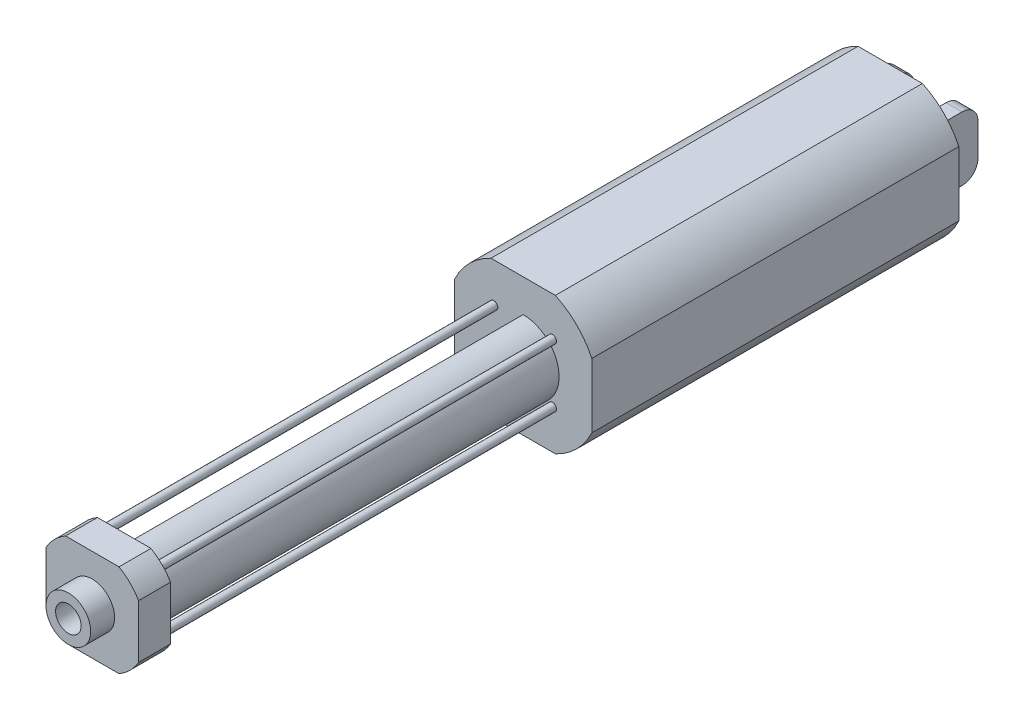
SolidWorks part; units mm, degrees
ref_plane "Plan1" through (0, 0, 0) normal (0, 0, 1) x (1, 0, 0)
ref_plane "Plan2" through (0, 0, 0) normal (0, 1, 0) x (1, 0, 0)
ref_plane "Plan3" through (0, 0, 0) normal (1, 0, 0) x (0, 0, -1)
sketch "Esquisse1" plane through (0, 0, 0) normal (0, 0, 1) x (1, 0, 0)
  line L0 (0, 86) -> (86, 0) construction
  line L1 (0, 0) -> (86, 0) construction
  line L2 (0, 0) -> (0, 86) construction
  line L3 (0, 86) -> (86, 86) construction
  line L4 (86, 0) -> (86, 86) construction
  line L6 (22.8196, 86) -> (63.1804, 86)
  line L7 (0, 63.1804) -> (0, 22.8196)
  line L8 (22.8196, 0) -> (63.1804, 0)
  line L9 (86, 63.1804) -> (86, 22.8196)
  arc A0 (86, 63.1804) -> (63.1804, 86) centre (43, 43) ccw
  arc A1 (22.8196, 86) -> (0, 63.1804) centre (43, 43) ccw
  arc A2 (0, 22.8196) -> (22.8196, 0) centre (43, 43) ccw
  arc A3 (63.1804, 0) -> (86, 22.8196) centre (43, 43) ccw
  dimension "D3" = 95
  dimension "D1" = 86
  dimension "D2" = 86
extrude "Base-Extrusion" add sketch "Esquisse1" along normal blind 230
sketch "Esquisse2" plane through (0, 0, 230) normal (0, 0, 1) x (1, 0, 0)
  line L0 (43, 86) -> (43, 0) construction
  line L1 (63.1804, 86) -> (22.8196, 86) construction
  line L2 (22.8196, 0) -> (63.1804, 0) construction
  line L3 (43, 43) -> (73, 43) construction
  line L4 (43, 43) -> (13, 43) construction
  line L5 (43, 65.5) -> (43, 63)
  line L6 (20.5, 43) -> (23, 43)
  arc A0 (20.5, 43) -> (43, 65.5) centre (43, 43) ccw
  arc A1 (23, 43) -> (43, 63) centre (43, 43) ccw
  dimension "D1" = 45
  dimension "D2" = 40
extrude "Boss.-Extru.1" add sketch "Esquisse2" along normal blind 250
sketch "Esquisse3" plane through (0, 0, 0) normal (0, 0, -1) x (-1, 0, 0)
  line L0 (-43, 86) -> (-43, 0) construction
  line L1 (-63.1804, 86) -> (-22.8196, 86) construction
  line L2 (-22.8196, 0) -> (-63.1804, 0) construction
  line L3 (-86, 43) -> (0, 43) construction
  line L4 (-86, 22.8196) -> (-86, 63.1804) construction
  line L5 (0, 63.1804) -> (0, 22.8196) construction
  line L6 (-68, 23) -> (-58, 23)
  line L7 (-68, 63) -> (-58, 63)
  line L8 (-68, 63) -> (-68, 23)
  line L9 (-28, 63) -> (-28, 23)
  line L10 (-58, 63) -> (-58, 23)
  line L11 (-18, 63) -> (-18, 23)
  line L12 (-18, 63) -> (-28, 63)
  line L13 (-18, 23) -> (-28, 23)
  point P14 (-58, 43)
  point P18 (-68, 43)
  point P22 (-18, 43)
  point P23 (-28, 43)
  dimension "D1" = 30
  dimension "D2" = 10
  dimension "D3" = 20
extrude "Boss.-Extru.2" add sketch "Esquisse3" along normal blind 30
sketch "Esquisse4" plane through (18, 0, 0) normal (-1, 0, 0) x (0, 0, 1)
  line L0 (0, 63) -> (-30, 23) construction
  circle A0 centre (-15, 43) radius 6
  dimension "D1" = 12
extrude "Boss.-Extru.3" add sketch "Esquisse4" against normal up to surface (50 mm away)
fillet "Congé1" radius 10 4 edges at (63, 23, -30) (63, 63, -30) (23, 63, -30) (23, 23, -30)
sketch "Esquisse6" plane through (0, 0, 480) normal (0, 0, 1) x (1, 0, 0)
  line L0 (63.1804, 86) -> (22.8196, 86) construction
  line L1 (0, 63.1804) -> (0, 22.8196) construction
  line L2 (22.8196, 0) -> (63.1804, 0) construction
  line L3 (86, 22.8196) -> (86, 63.1804) construction
  line L4 (63.1804, 86) -> (22.8196, 86) construction
  line L5 (0, 63.1804) -> (0, 22.8196) construction
  line L6 (22.8196, 0) -> (63.1804, 0) construction
  line L7 (86, 22.8196) -> (86, 63.1804) construction
  line L8 (26.2295, 14) -> (59.7705, 14)
  line L9 (14, 59.7705) -> (14, 26.2295)
  line L10 (59.7705, 72) -> (26.2295, 72)
  line L11 (72, 26.2295) -> (72, 59.7705)
  arc A0 (86, 63.1804) -> (63.1804, 86) centre (43, 43) ccw construction
  arc A1 (86, 63.1804) -> (63.1804, 86) centre (43, 43) ccw construction
  arc A2 (22.8196, 86) -> (0, 63.1804) centre (43, 43) ccw construction
  arc A3 (0, 22.8196) -> (22.8196, 0) centre (43, 43) ccw construction
  arc A4 (63.1804, 0) -> (86, 22.8196) centre (43, 43) ccw construction
  arc A5 (22.8196, 86) -> (0, 63.1804) centre (43, 43) ccw construction
  arc A6 (0, 22.8196) -> (22.8196, 0) centre (43, 43) ccw construction
  arc A7 (63.1804, 0) -> (86, 22.8196) centre (43, 43) ccw construction
  arc A8 (59.7705, 14) -> (72, 26.2295) centre (43, 43) ccw
  arc A9 (14, 26.2295) -> (26.2295, 14) centre (43, 43) ccw
  arc A10 (26.2295, 72) -> (14, 59.7705) centre (43, 43) ccw
  arc A11 (72, 59.7705) -> (59.7705, 72) centre (43, 43) ccw
  dimension "D1" = 14
extrude "Boss.-Extru.4" add sketch "Esquisse6" along normal blind 20
sketch "Esquisse7" plane through (0, 0, 500) normal (0, 0, 1) x (1, 0, 0)
  line L0 (14, 43) -> (72, 43) construction
  line L3 (72, 26.2295) -> (72, 59.7705) construction
  line L4 (14, 59.7705) -> (14, 26.2295) construction
  line L5 (24.6152, 61.3848) -> (43, 43) construction
  circle A0 centre (24.6152, 61.3848) radius 2.5
  dimension "D1" = 5
  dimension "D2" = 45
  dimension "D3" = 26
extrude "Boss.-Extru.5" add sketch "Esquisse7" along normal up to surface (270 mm away)
pattern_circular "Répétition circulaire1" count 4 over 360 about axis through (43, 43, 0) along (0, 0, 1) of "Boss.-Extru.5"
sketch "Esquisse8" plane through (0, 0, 500) normal (0, 0, 1) x (1, 0, 0)
  circle A0 centre (43, 43) radius 14
  arc A1 (23, 43) -> (43, 63) centre (43, 43) ccw construction
  dimension "D1" = 28
extrude "Boss.-Extru.6" add sketch "Esquisse8" along normal blind 15
sketch "Esquisse9" plane through (0, 0, 515) normal (0, 0, 1) x (1, 0, 0)
  circle A0 centre (43, 43) radius 8
  circle A1 centre (43, 43) radius 14 construction
  dimension "D1" = 16
extrude "Enlèv. mat.-Extru.2" cut sketch "Esquisse9" against normal up to next
sketch "Esq_WRNL_Compact001" plane through (0, 0, 0) normal (0, 0, 1) x (1, 0, 0)
  line L0 (-1, -1) -> (-1, 87)
  line L1 (87, -1) -> (87, 87)
  line L2 (-1, -1) -> (87, -1)
  line L3 (-1, 87) -> (87, 87)
